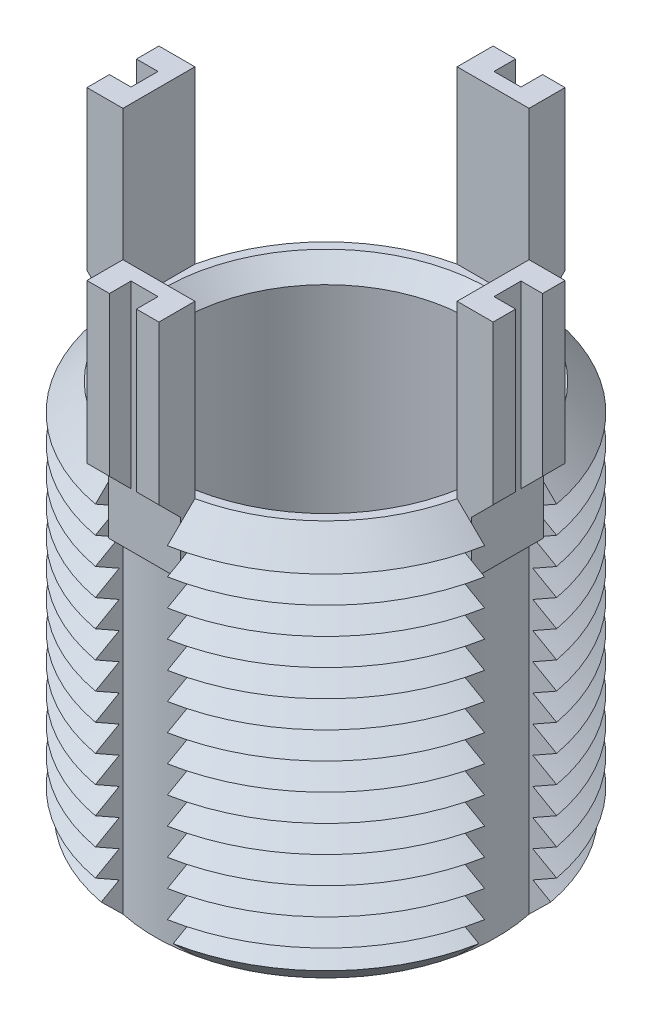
SolidWorks part; units mm, degrees
ref_plane "Front Plane" through (0, 0, 0) normal (0, 0, 1) x (1, 0, 0)
ref_plane "Top Plane" through (0, 0, 0) normal (0, 1, 0) x (1, 0, 0)
ref_plane "Right Plane" through (0, 0, 0) normal (1, 0, 0) x (0, 0, -1)
sketch "Sketch1" plane through (0, 0, 0) normal (0, 1, 0) x (1, 0, 0)
  circle A0 centre (0, 0) radius 11
  dimension "D1" = 22
extrude "Boss-Extrude1" add sketch "Sketch1" against normal blind 22
chamfer "Chamfer1" distance 1.5 angle 45 2 edges at (0, -22, 11) (0, 0, 11)
sketch "Sketch2" plane through (0, 0, 0) normal (1, 0, 0) x (0, 0, -1)
  line L0 (0, 0.8859) -> (0, -9.2617) construction
sketch "Sketch3" plane through (0, 0, 0) normal (1, 0, 0) x (0, 0, -1)
  line L0 (-11, -1.5) -> (-9.701, -2.25)
  line L1 (-9.701, -2.25) -> (-11, -3)
  line L2 (-11, -1.5) -> (-11, -20.5) construction
  line L3 (-11, -3) -> (-11, -1.5)
  dimension "D1" = 1.5
revolve "Cut-Revolve1" cut sketch "Sketch3" angle 360 about L0
pattern_linear "LPattern1" count 13 spacing 1.5 along (0, -1, 0) of "Cut-Revolve1"
sketch "Sketch4" plane through (0, 0, 0) normal (0, 1, 0) x (1, 0, 0)
  line L0 (-9.2871, 2) -> (-10.8167, 2)
  line L2 (-10.8167, -2) -> (-9.2871, -2)
  arc A0 (-9.2871, 2) -> (-9.2871, -2) centre (0, 0) ccw
  arc A1 (-10.8167, 2) -> (-10.8167, -2) centre (0, 0) ccw
  circle A2 centre (0, 0) radius 11 construction
  circle A3 centre (0, 0) radius 9.5 construction
  point P1 (-9.5, 0)
  point P3 (-11, 0)
  point P13 (0, 0)
  dimension "D1" = 4
extrude "Cut-Extrude1" cut sketch "Sketch4" against normal up to surface (22 mm away)
pattern_circular "CirPattern1" count 4 over 360 about axis through (0, 0, 0) along (0, 1, 0) of "Cut-Extrude1"
sketch "Sketch5" plane through (0, 0, 0) normal (1, 0, 0) x (0, 0, -1)
  line L0 (-9.2871, 9.5) -> (-9.2871, -3.5)
  line L1 (-9.2871, -3.5) -> (-10.0871, -3.5)
  line L2 (-10.0871, -3.5) -> (-10.0871, -0.5)
  line L3 (-10.0871, -0.5) -> (-11.2871, 0.7)
  line L4 (-11.2871, 0.7) -> (-11.2871, 9.5)
  line L5 (-11.2871, 9.5) -> (-9.2871, 9.5)
  line L6 (-10.8167, -4.5) -> (-2, -4.5) construction
  point P9 (-2, 0)
  point P10 (-10.0871, -0.5)
  dimension "D1" = 1
  dimension "D2" = 13
  dimension "D3" = 10
  dimension "D4" = 2
  dimension "D5" = 0.8
  dimension "D6" = 45
extrude "Boss-Extrude3" add sketch "Sketch5" along normal mid plane 4
pattern_circular "CirPattern2" count 4 over 360 about axis through (0, 0, 0) along (0, 1, 0) of "Boss-Extrude3"
sketch "Sketch6" plane through (0, 9.5, 0) normal (0, 1, 0) x (1, 0, 0)
  line L0 (-11.2871, -2) -> (-11.2871, 2) construction
  line L1 (-11.2871, -0.75) -> (-10.0871, -0.75)
  line L2 (-11.2871, -0.75) -> (-11.2871, 0.75)
  line L3 (-11.2871, 0.75) -> (-10.0871, 0.75)
  line L4 (-10.0871, -0.75) -> (-10.0871, 0.75)
  line L5 (-11.2871, -0.75) -> (-10.0871, 0.75) construction
  line L6 (-11.2871, 0.75) -> (-10.0871, -0.75) construction
  line L7 (11.2871, 2) -> (11.2871, -2) construction
  line L8 (-0.75, 10.0871) -> (0.75, 10.0871)
  line L9 (-0.75, 10.0871) -> (-0.75, 11.2871)
  line L10 (-0.75, 11.2871) -> (0.75, 11.2871)
  line L11 (0.75, 10.0871) -> (0.75, 11.2871)
  line L12 (-0.75, 10.0871) -> (0.75, 11.2871) construction
  line L13 (-0.75, 11.2871) -> (0.75, 10.0871) construction
  line L14 (10.0871, -0.75) -> (11.2871, -0.75)
  line L15 (10.0871, -0.75) -> (10.0871, 0.75)
  line L16 (10.0871, 0.75) -> (11.2871, 0.75)
  line L17 (11.2871, -0.75) -> (11.2871, 0.75)
  line L18 (10.0871, -0.75) -> (11.2871, 0.75) construction
  line L19 (10.0871, 0.75) -> (11.2871, -0.75) construction
  line L20 (-0.75, -11.2871) -> (0.75, -11.2871)
  line L21 (-0.75, -11.2871) -> (-0.75, -10.0871)
  line L22 (-0.75, -10.0871) -> (0.75, -10.0871)
  line L23 (0.75, -11.2871) -> (0.75, -10.0871)
  line L24 (-0.75, -11.2871) -> (0.75, -10.0871) construction
  line L25 (-0.75, -10.0871) -> (0.75, -11.2871) construction
  line L26 (-2, 11.2871) -> (2, 11.2871) construction
  line L27 (2, -11.2871) -> (-2, -11.2871) construction
  point P0 (-10.6871, 0)
  point P7 (-11.2871, 0)
  point P8 (-11.2871, 0)
  point P9 (0, 10.6871)
  point P14 (10.6871, 0)
  point P19 (0, -10.6871)
  point P24 (0, 11.2871)
  point P25 (11.2871, 0)
  point P26 (11.2871, 0)
  point P27 (0, 11.2871)
  point P30 (0, -11.2871)
  point P33 (0, -11.2871)
  dimension "D1" = 1.5
  dimension "D2" = 1.2
extrude "Cut-Extrude3" cut sketch "Sketch6" against normal through all both and the other way through all
sketch "Sketch7" plane through (0, 0, 0) normal (0, 1, 0) x (1, 0, 0)
  circle A0 centre (0, 0) radius 8
  dimension "D1" = 16
extrude "Cut-Extrude4" cut sketch "Sketch7" against normal up to surface (22 mm away)
chamfer "Chamfer2" distance 1 angle 45 2 edges at (0, 0, 8) (0, -22, 8)
